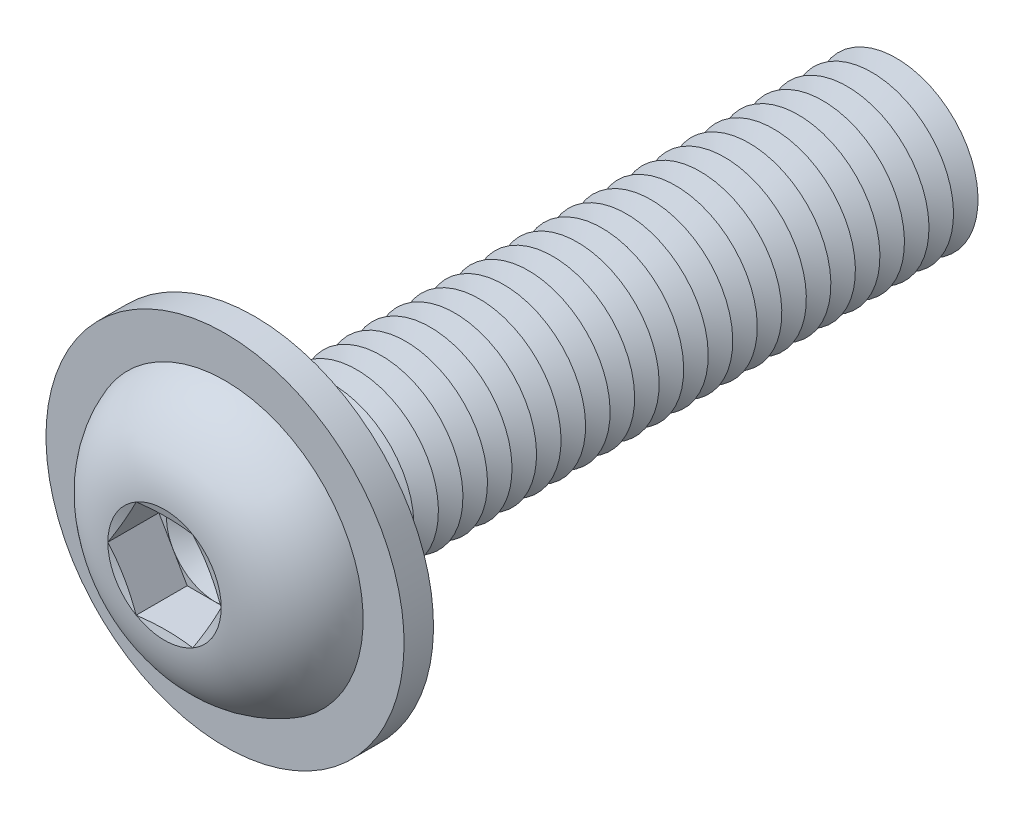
SolidWorks part; units mm, degrees
ref_plane "Front Plane" through (0, 0, 0) normal (0, 0, 1) x (1, 0, 0)
ref_plane "Top Plane" through (0, 0, 0) normal (0, 1, 0) x (1, 0, 0)
ref_plane "Right Plane" through (0, 0, 0) normal (1, 0, 0) x (0, 0, -1)
sketch "Sketch1" plane through (0, 0, 0) normal (1, 0, 0) x (0, 0, -1)
  line L0 (0, 5) -> (0, 8.75)
  line L3 (0, 5) -> (40, 5)
  line L4 (40, 5) -> (40, 0)
  line L5 (40, 0) -> (-5.5, 0) construction
  line L6 (-5.5, 0) -> (40, 0)
  line L7 (-5.5, 3.4641) -> (-5.5, 1.732) construction
  line L8 (-5.5, 1.732) -> (-5.5, 0)
  line L9 (-5.5, 3.4641) -> (-5.0359, 1.732)
  line L10 (-5.0359, 1.732) -> (-5.5, 1.732)
  line L11 (40, 0) -> (22.7481, 0) construction
  line L12 (0, 8.75) -> (-5.5, 8.75) construction
  arc A1 (0, 8.75) -> (-5.5, 3.4641) centre (0, 3.2457) ccw
  point P8 (40, 2.5)
  dimension "D1" = 17.5
  dimension "D2" = 10
  dimension "D3" = 5.5
  dimension "D4" = 6.9282
  dimension "D5" = 40
  dimension "D6" = 15
revolve "Revolve1" add sketch "Sketch1" angle 360 about L5
fillet "Fillet1" radius 0.75 1 edges at (0, 5, 0)
sketch "Sketch2" plane through (0, 0, 0) normal (1, 0, 0) x (0, 0, -1)
  line L0 (39.25, 5) -> (40.75, 5)
  line L1 (40, 5) -> (0.75, 5) construction
  line L2 (40.75, 5) -> (40, 3.701)
  line L3 (40, -5) -> (40, 5) construction
  line L4 (40, 3.701) -> (39.25, 5)
  dimension "D1" = 1.5
revolve "Cut-Revolve1" cut sketch "Sketch2" angle 360 about axis through (0, 0, -40) along (0, 0, -1)
pattern_linear "LPattern1" count 26 spacing 1.5 along (0, 0, 1) of "Cut-Revolve1"
sketch "Sketch3" plane through (0, 0, 5.5) normal (0, 0, 1) x (1, 0, 0)
  line L7 (1.732, 3) -> (-1.7321, 3)
  line L8 (-1.7321, 3) -> (-3.4641, 0)
  line L9 (-3.4641, 0) -> (-1.732, -3)
  line L10 (-1.732, -3) -> (1.732, -3)
  line L11 (1.732, -3) -> (3.4641, 0)
  line L12 (3.4641, 0) -> (1.732, 3)
  circle A0 centre (0, 0) radius 3 construction
  circle A3 centre (0, 0) radius 3.4641 construction
extrude "Cut-Extrude1" cut sketch "Sketch3" against normal blind 3.12
sketch "Sketch4" plane through (0, 0, 2.38) normal (0, 0, 1) x (1, 0, 0)
  line L1 (1.732, 3) -> (-1.7321, 3) construction
  circle A0 centre (0, 0) radius 3
extrude "Cut-Extrude2" cut sketch "Sketch4" against normal through all draft 60
sketch "Sketch5" plane through (0, 0, 0) normal (0, 0, -1) x (-1, 0, 0)
  circle A0 centre (0, 0) radius 10.95
  circle A1 centre (0, 0) radius 5.75
  circle A2 centre (0, 0) radius 5.75 construction
  dimension "D1" = 21.9
extrude "Boss-Extrude1" add sketch "Sketch5" against normal blind 1.8
